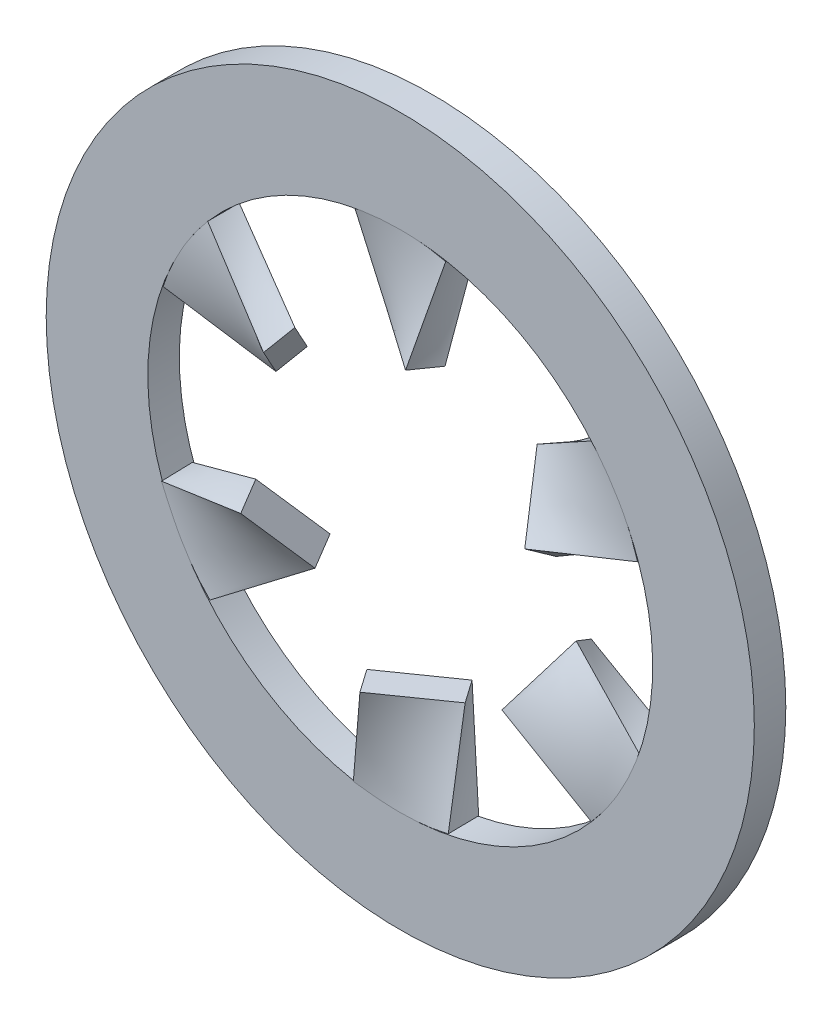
SolidWorks part; units mm, degrees
ref_plane "Front Plane" through (0, 0, 0) normal (0, 0, 1) x (1, 0, 0)
ref_plane "Top Plane" through (0, 0, 0) normal (0, 1, 0) x (1, 0, 0)
ref_plane "Right Plane" through (0, 0, 0) normal (1, 0, 0) x (0, 0, -1)
sketch "Sketch1" plane through (0, 0, 0) normal (0, 0, 1) x (1, 0, 0)
  line L0 (0, 1.4605) -> (0, 3.429) construction
  circle A0 centre (0, 0) radius 1.4605
  circle A1 centre (0, 0) radius 3.429
  circle A3 centre (0, 0) radius 2.4447 construction
  point P6 (0, 2.4447)
  point P7 (-1.4605, 0)
  dimension "ID" = 2.921
  dimension "OD" = 6.858
ref_plane "Plane1" through (0, 1.4605, 0) normal (0, 1, 0) x (-1, 0, 0)
ref_plane "Plane2" through (0, 2.4447, 0) normal (0, 1, 0) x (-1, 0, 0)
sketch "Sketch2" plane through (0, 2.4447, 0) normal (0, 1, 0) x (-1, 0, 0)
  line L0 (-0.4572, 0) -> (0.4572, 0) construction
  line L1 (-0.4572, 0.1524) -> (0.4572, 0.1524)
  line L2 (-0.4572, 0.1524) -> (-0.4572, -0.1524)
  line L3 (-0.4572, -0.1524) -> (0.4572, -0.1524)
  line L4 (0.4572, 0.1524) -> (0.4572, -0.1524)
  line L5 (0, 0) -> (0, 0.1524) construction
  line L6 (2.4447, 0) -> (-2.4447, 0) construction
sketch "Sketch3" plane through (0, 1.4605, 0) normal (0, 1, 0) x (-1, 0, 0)
  line L0 (-0.2209, 0.3221) -> (-0.3783, 0.0974)
  line L1 (-0.2209, 0.3221) -> (0.3783, -0.0974)
  line L2 (-0.3783, 0.0974) -> (0.2209, -0.3221)
  line L3 (0.3783, -0.0974) -> (0.2209, -0.3221)
  line L4 (-0.2996, 0.2098) -> (0.2996, -0.2098) construction
  line L5 (0.0787, 0.1124) -> (-0.0787, -0.1124) construction
  line L7 (2.4447, 0) -> (-2.4447, 0) construction
loft "Loft1" add profiles "Sketch2", "Sketch3"
ref_axis "Axis1" through (0, 0, -0.647) along (0, 0, 1)
pattern_circular "CirPattern1" count 6 over 360 about axis through (0, 0, -0.647) along (0, 0, 1)
sketch "Sketch4" plane through (0, 0, 0) normal (0, 0, 1) x (1, 0, 0)
  circle A0 centre (0, 0) radius 2.4447 construction
  circle A1 centre (0, 0) radius 2.4447
extrude "Cut-Extrude1" cut sketch "Sketch4" against normal through all and the other way through all flip side to cut
sketch "Sketch5" plane through (0, 0, 0) normal (0, 0, 1) x (1, 0, 0)
  circle A0 centre (0, 0) radius 3.429 construction
  circle A1 centre (0, 0) radius 2.4447 construction
  circle A2 centre (0, 0) radius 3.429
  circle A3 centre (0, 0) radius 2.4447
extrude "Extrude1" add sketch "Sketch5" along normal mid plane 0.3048
equation "\"D1@Sketch2\" = \"thickness@Sketch2\" * 3"
equation "\"D1@Sketch3\" = \"D1@Sketch2\" * 0.8"
equation "\"D2@Sketch3\" = \"thickness@Sketch2\" * 0.9"
equation "\"D1@Extrude1\" = \"thickness@Sketch2\""
